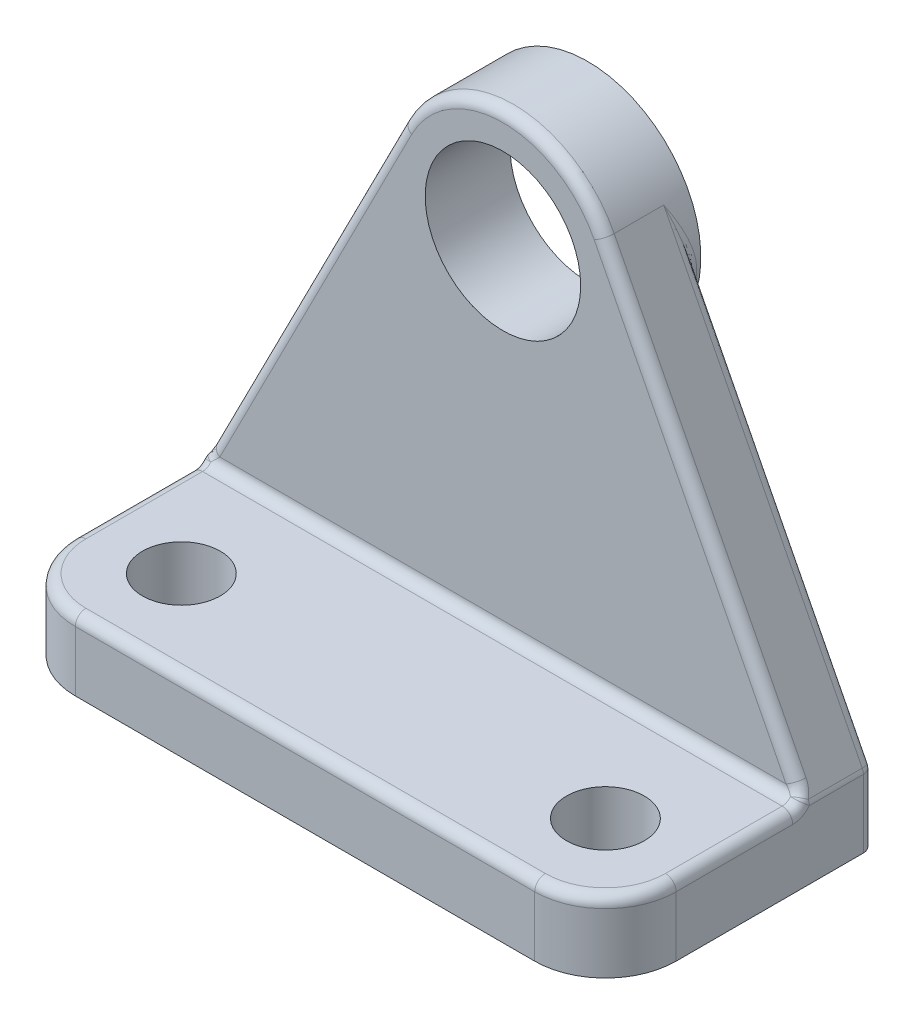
SolidWorks part; units mm, degrees
ref_plane "Front Plane" through (0, 0, 0) normal (0, 0, 1) x (1, 0, 0)
ref_plane "Top Plane" through (0, 0, 0) normal (0, 1, 0) x (1, 0, 0)
ref_plane "Right Plane" through (0, 0, 0) normal (1, 0, 0) x (0, 0, -1)
sketch "Sketch1" plane through (0, 0, 0) normal (0, 0, 1) x (1, 0, 0)
  line L0 (0, -10) -> (0, 80) construction
  line L1 (-42.5, 0) -> (42.5, 0)
  line L2 (42.5, 0) -> (42.5, 10)
  line L3 (42.5, 10) -> (14.2472, 65.2814)
  line L4 (-42.5, 10) -> (-14.2472, 65.2814)
  line L5 (-42.5, 0) -> (-42.5, 10)
  arc A0 (14.2472, 65.2814) -> (-14.2472, 65.2814) centre (0, 58) ccw
  point P11 (0, 0)
  dimension "D1" = 32
  dimension "D2" = 42.5
  dimension "D3" = 10
  dimension "D4" = 58
extrude "Extrude1" add sketch "Sketch1" along normal blind 38
sketch "Sketch2" plane through (0, 0, 0) normal (1, 0, 0) x (0, 0, -1)
  line L1 (0, 74) -> (-38, 74) construction
  line L2 (-38, 10) -> (-10, 10)
  line L3 (-38, 10) -> (-38, 74)
  line L4 (-38, 74) -> (-10, 74)
  line L5 (-10, 10) -> (-10, 74)
  line L6 (0, 10) -> (0, 65.2814) construction
  dimension "D1" = 10
extrude "Cut-Extrude1" cut sketch "Sketch2" against normal through all and the other way through all
sketch "Sketch3" plane through (0, 0, 0) normal (0, 0, -1) x (-1, 0, 0)
  circle A0 centre (0, 58) radius 16
  arc A1 (14.2472, 65.2814) -> (-14.2472, 65.2814) centre (0, 58) ccw construction
extrude "Extrude2" add sketch "Sketch3" along normal blind 2
sketch "Sketch4" plane through (0, 0, 10) normal (0, 0, 1) x (1, 0, 0)
  circle A0 centre (0, 58) radius 11
  arc A1 (14.2472, 65.2814) -> (-14.2472, 65.2814) centre (0, 58) ccw construction
  dimension "D1" = 22
extrude "Cut-Extrude2" cut sketch "Sketch4" against normal through all
sketch "Sketch7" plane through (0, 10, 0) normal (0, 1, 0) x (1, 0, 0)
  line L0 (42.5, 0) -> (14.2472, 0) construction
  line L1 (0, 10) -> (0, -60) construction
  circle A0 centre (30, -25.5) radius 5.5
  circle A1 centre (-30, -25.5) radius 5.5
  dimension "D1" = 30
  dimension "D3" = 11
  dimension "D2" = 25.5
extrude "Cut-Extrude3" cut sketch "Sketch7" against normal through all
fillet "Fillet1" radius 10 2 edges at (-42.5, 5, 38) (42.5, 5, 38)
fillet "Fillet2" radius 1.5 16 edges at (-42.5, 10, 5) (-42.5, 5, 0) (42.5, 5, 0) (42.5, 10, 5) (0, 10, 10) (42.5, 10, 19) (39.5711, 10, 35.0711) (0, 10, 38) (-39.5711, 10, 35.0711) (-42.5, 10, 19) (-28.3736, 37.6407, 10) (0, 74, 10) (28.3736, 37.6407, 10)
